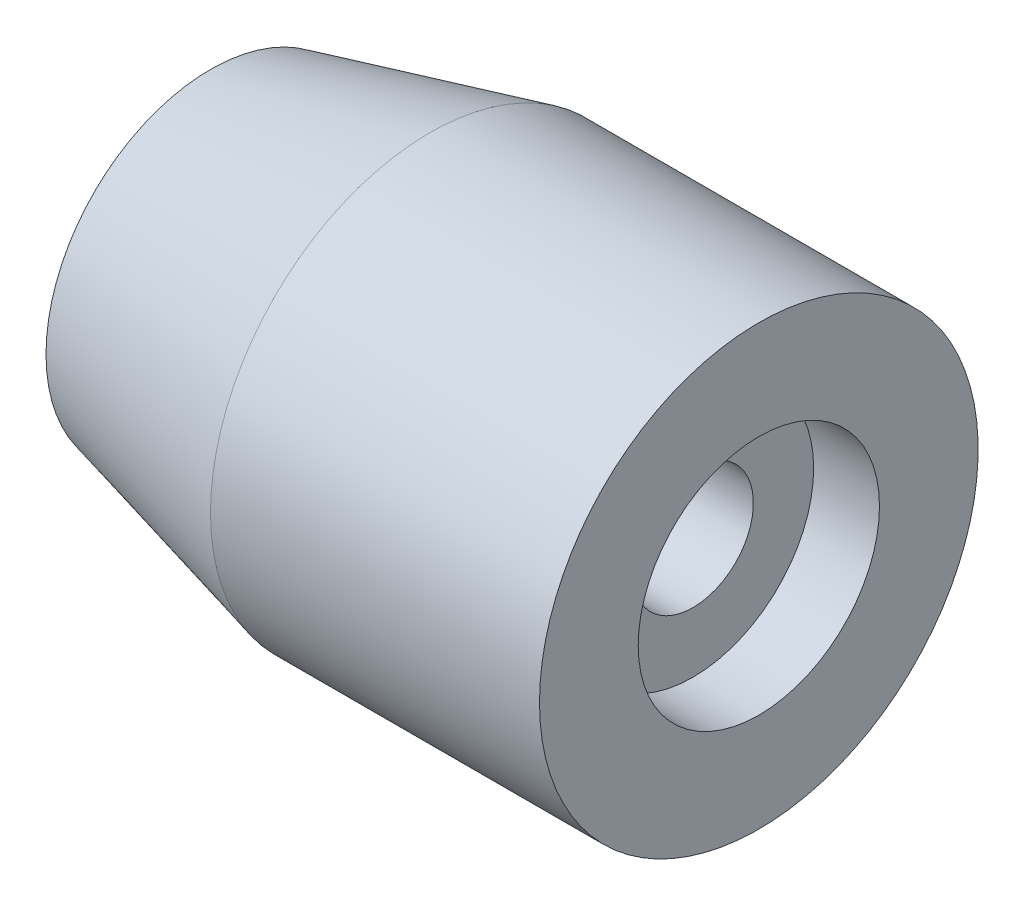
SolidWorks part; units mm, degrees
ref_plane "Plan de face" through (0, 0, 0) normal (0, 0, 1) x (1, 0, 0)
ref_plane "Plan de dessus" through (0, 0, 0) normal (0, 1, 0) x (1, 0, 0)
ref_plane "Plan de droite" through (0, 0, 0) normal (1, 0, 0) x (0, 0, -1)
sketch "Esquisse1" plane through (0, 0, 0) normal (0, 0, 1) x (1, 0, 0)
  line L0 (-7.0138, 0) -> (7.7172, 0) construction
  line L1 (-18.4129, 2.75) -> (3.5871, 2.75)
  line L2 (3.5871, 2.75) -> (3.5871, 5.5)
  line L3 (3.5871, 5.5) -> (6.5871, 5.5)
  line L4 (6.5871, 5.5) -> (6.5871, 10)
  line L5 (6.5871, 10) -> (-8.4129, 10)
  line L6 (-8.4129, 10) -> (-18.4129, 7.5)
  line L7 (-18.4129, 7.5) -> (-18.4129, 2.75)
  point P5 (5.0871, 5.5)
  point P11 (-18.4129, 5.125)
  point P12 (3.5871, 4.125)
revolve "Révolution1" add sketch "Esquisse1" angle 360 about L0
equation "\"D6@Esquisse1\"=\"D4@Esquisse1\"-10"
